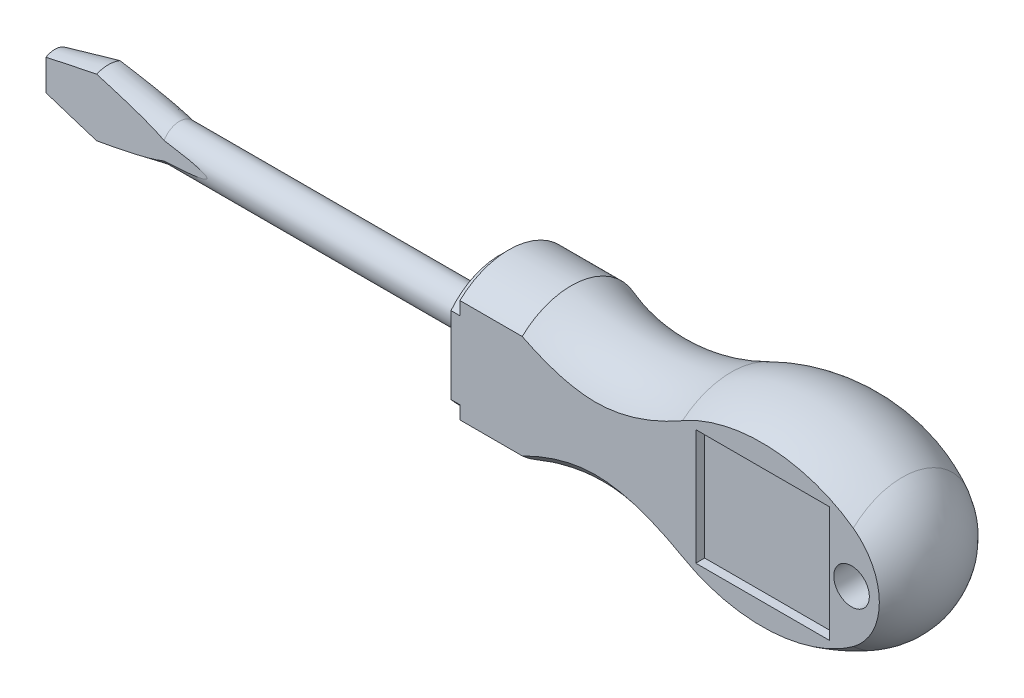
SolidWorks part; units mm, degrees
ref_plane "Спереди" through (0, 0, 0) normal (0, 0, 1) x (1, 0, 0)
ref_plane "Сверху" through (0, 0, 0) normal (0, 1, 0) x (1, 0, 0)
ref_plane "Справа" through (0, 0, 0) normal (1, 0, 0) x (0, 0, -1)
other "Configuration Table"
sketch "Эскиз1" plane through (0, 0, 0) normal (0, 0, 1) x (1, 0, 0)
  line L0 (0, 0) -> (0, 7.9615) construction
  line L1 (-42, 8) -> (-49, 8)
  line L2 (-49, 8) -> (-49, 7)
  line L3 (-49, 7) -> (-50, 7)
  line L4 (-50, 7) -> (-50, 2)
  line L5 (-100, 0) -> (0, 0)
  line L6 (-100, 0) -> (-200, 0) construction
  line L7 (-50, 2) -> (-86, 2)
  line L10 (-15.0622, 10.5) -> (-15.0622, 0) construction
  line L11 (-15.0622, 10.5) -> (0, 10.5) construction
  line L12 (-86, 2) -> (-94, 3.5)
  line L14 (-100, 2) -> (-100, 0)
  line L15 (-94, 3.5) -> (-100, 2)
  arc A0 (0, 0) -> (-4.8031, 7.9615) centre (-9, 0) ccw
  arc A1 (-4.8031, 7.9615) -> (-23.9971, 8.6039) centre (-15.0622, -11.5) ccw
  arc A2 (-23.9971, 8.6039) -> (-42, 8) centre (-33.7444, 30.5354) cw
  dimension "D1" = 9
  dimension "D2" = 22
  dimension "D3" = 24
  dimension "D4" = 49
  dimension "D5" = 1
  dimension "D6" = 14
  dimension "D7" = 16
  dimension "D8" = 7
  dimension "D9" = 100
  dimension "D10" = 14
  dimension "D11" = 6
  dimension "D12" = 7
  dimension "D13" = 21
  dimension "D14" = 4
revolve "Повернуть1" add sketch "Эскиз1" angle 360 about L6
sketch "Эскиз8" plane through (0, 0, 0) normal (0, 1, 0) x (1, 0, 0)
  line L0 (-50, 7) -> (-50, -7) construction
  line L1 (-50, -5.5) -> (0, -5.5)
  line L2 (-50, -5.5) -> (-50, -21.5)
  line L3 (-50, -21.5) -> (0, -21.5)
  line L4 (0, -5.5) -> (0, -21.5)
  line L5 (-15.0622, -5.5) -> (-15.0622, 10.5) construction
  line L6 (-15.0622, 10.5) -> (0.9378, 10.5) construction
  arc A0 (-4.8031, 7.9615) -> (-23.9971, 8.6039) centre (-15.0622, -11.5) ccw construction
  dimension "D1" = 16
extrude "Вырез-Вытянуть2" cut sketch "Эскиз8" against normal through all and the other way through all
sketch "Эскиз9" plane through (0, 0, 5.5) normal (0, 0, 1) x (1, 0, 0)
  line L0 (-5, 0) -> (0, 0) construction
  circle A0 centre (-5, 0) radius 2
  dimension "D2" = 4
  dimension "D1" = 5
extrude "Вырез-Вытянуть3" cut sketch "Эскиз9" against normal through all
sketch "Эскиз11" plane through (0, 0, 0) normal (0, 1, 0) x (1, 0, 0)
  line L0 (-94, 0) -> (-100, 0) construction
  line L1 (-94, -3.5) -> (-94, 3.5) construction
  line L2 (-100, 2) -> (-100, -2) construction
  line L3 (-100, 1) -> (-80.9189, 2)
  line L4 (-50, 2) -> (-86, 2) construction
  line L5 (-80.9189, 2) -> (-80.9189, 8)
  line L6 (-80.9189, 8) -> (-100, 8)
  line L7 (-100, 8) -> (-100, 1)
  line L8 (-100, -8) -> (-100, -1)
  line L9 (-80.9189, -8) -> (-100, -8)
  line L10 (-80.9189, -2) -> (-80.9189, -8)
  line L11 (-100, -1) -> (-80.9189, -2)
  dimension "D1" = 6
  dimension "D2" = 2
extrude "Вырез-Вытянуть5" cut sketch "Эскиз11" against normal through all and the other way through all
sketch "Эскиз12" plane through (0, 0, 5.5) normal (0, 0, 1) x (1, 0, 0)
  line L0 (-15, 0) -> (-5, 0) construction
  line L1 (-22.5, 6.5) -> (-7.5, 6.5)
  line L2 (-22.5, 6.5) -> (-22.5, -6.5)
  line L3 (-22.5, -6.5) -> (-7.5, -6.5)
  line L4 (-7.5, 6.5) -> (-7.5, -6.5)
  line L5 (-22.5, 6.5) -> (-7.5, -6.5) construction
  line L6 (-22.5, -6.5) -> (-7.5, 6.5) construction
  point P0 (-15, 0)
  dimension "D1" = 10
  dimension "D2" = 15
  dimension "D3" = 13
extrude "Вырез-Вытянуть6" cut sketch "Эскиз12" against normal blind 1
sketch "Эскиз14"
  line L0 (3.6547, -324.5526) -> (3.6547, 1040.7807) construction
